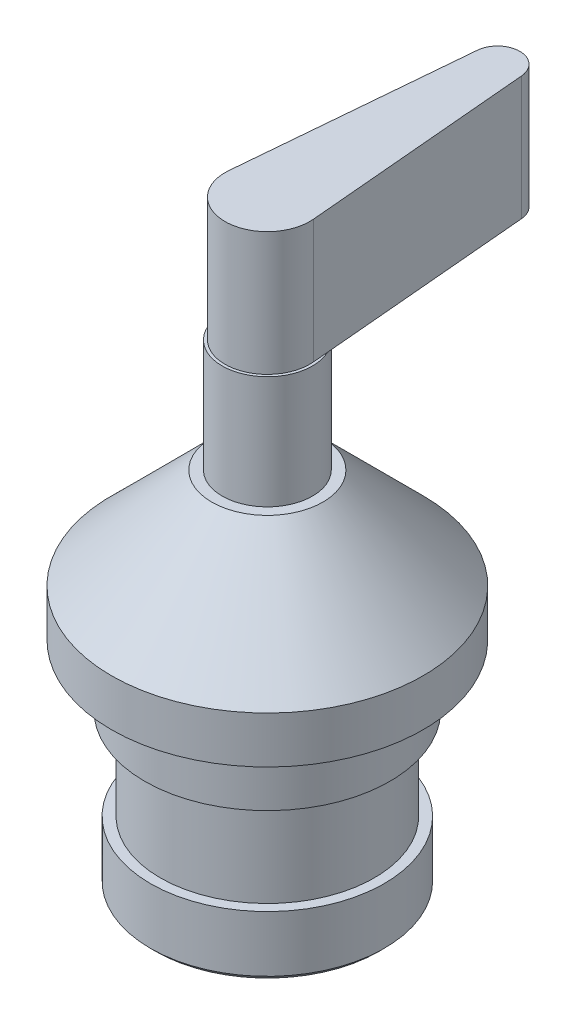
SolidWorks part; units mm, degrees
ref_plane "Front Plane" through (0, 0, 0) normal (0, 0, 1) x (1, 0, 0)
ref_plane "Top Plane" through (0, 0, 0) normal (0, 1, 0) x (1, 0, 0)
ref_plane "Right Plane" through (0, 0, 0) normal (1, 0, 0) x (0, 0, -1)
sketch "Sketch1" plane through (0, 0, 0) normal (0, 0, 1) x (1, 0, 0)
  line L0 (29.972, 0) -> (29.972, -14.986)
  line L1 (31.4325, 0) -> (-31.4325, 0) construction
  line L2 (26.162, -14.986) -> (26.162, -37.338)
  line L3 (28.575, -37.338) -> (28.575, -52.324)
  line L4 (26.162, -14.986) -> (29.972, -14.986)
  line L5 (26.162, -37.338) -> (28.575, -37.338)
  line L6 (28.575, -52.324) -> (0, -52.324)
  line L7 (29.972, 0) -> (38.1, 0)
  line L8 (38.1, 0) -> (38.1, 11.43)
  line L9 (38.1, 11.43) -> (13.589, 35.941)
  line L10 (13.589, 35.941) -> (11.049, 35.941)
  line L11 (11.049, 35.941) -> (11.049, 63.5)
  line L12 (11.049, 63.5) -> (0, 63.5)
  line L13 (0, -42.1195) -> (0, 42.1195) construction
  line L14 (0, 63.5) -> (0, -52.324)
  line L15 (0, 76.3243) -> (0, -90.6265) construction
  dimension "D1" = 22.098
  dimension "D2" = 57.15
  dimension "D3" = 59.944
  dimension "D4" = 52.324
  dimension "D5" = 63.5
  dimension "D6" = 2.413
  dimension "D7" = 14.986
  dimension "D8" = 22.352
  dimension "D10" = 76.2
  dimension "D11" = 135
  dimension "D12" = 2.54
  dimension "D13" = 11.43
revolve "Revolve1" add sketch "Sketch1" angle 360 about L15
chamfer "Chamfer1" distance 1.27 angle 45 1 edges at (0, -52.324, 28.575)
sketch "Sketch2" plane through (0, 63.5, 0) normal (0, 1, 0) x (-1, 0, 0)
  line L0 (0, 14.3742) -> (0, -32.3106) construction
  line L1 (0, 42.1195) -> (0, -42.1195) construction
  line L2 (-10.3184, -0.9052) -> (-5.4188, -56.7578)
  line L3 (10.3184, -0.9052) -> (5.4188, -56.7578)
  arc A0 (10.3184, -0.9052) -> (-10.3184, -0.9052) centre (0, 0) ccw
  arc A1 (-5.4188, -56.7578) -> (5.4188, -56.7578) centre (0, -56.2824) ccw
  dimension "D2" = 10.358
  dimension "D3" = 5.4396
  dimension "D1" = 61.722
extrude "Extrude1" add sketch "Sketch2" along normal blind 30.226
